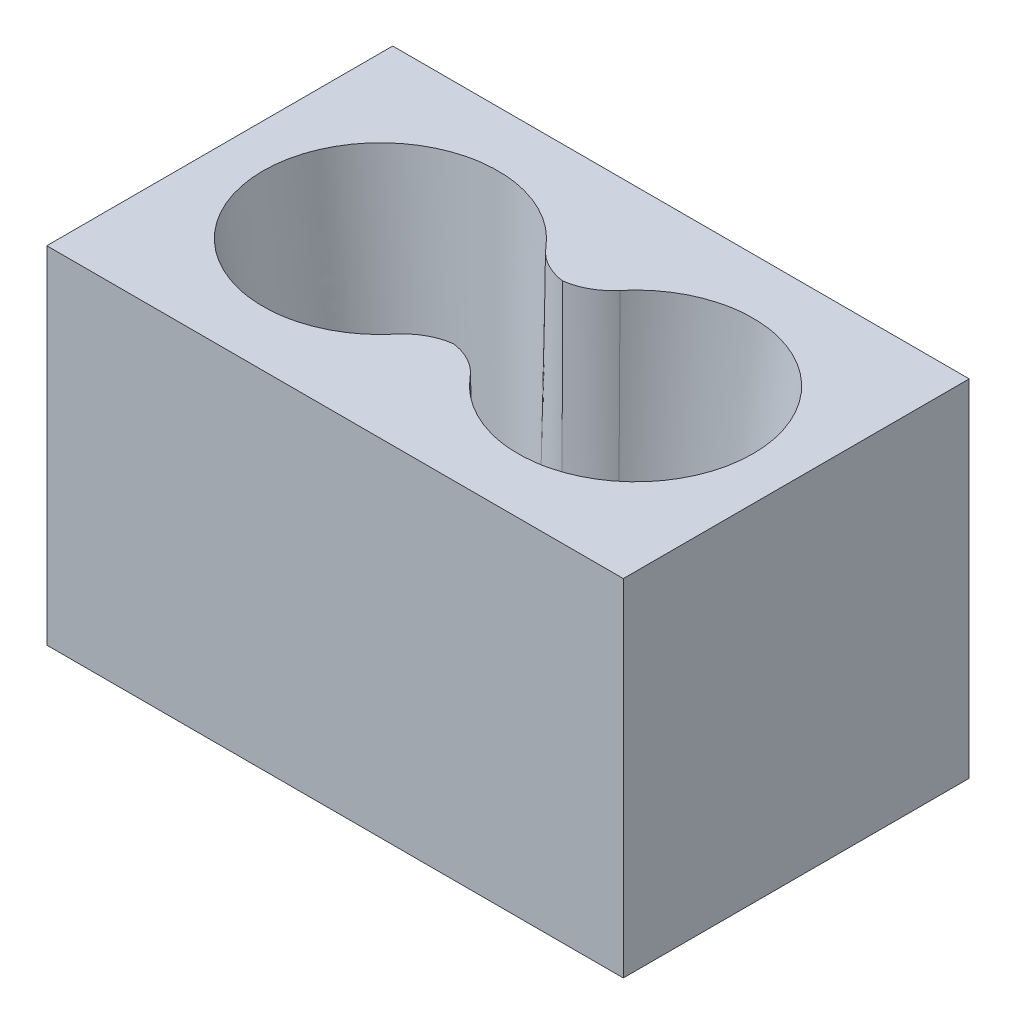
SolidWorks part; units mm, degrees
ref_plane "Front Plane" through (0, 0, 0) normal (0, 0, 1) x (1, 0, 0)
ref_plane "Top Plane" through (0, 0, 0) normal (0, 1, 0) x (1, 0, 0)
ref_plane "Right Plane" through (0, 0, 0) normal (1, 0, 0) x (0, 0, -1)
sketch "Sketch2" plane through (0, 0, 0) normal (0, 1, 0) x (1, 0, 0)
  line L1 (-100, -60) -> (100, -60)
  line L2 (-100, -60) -> (-100, 60)
  line L3 (-100, 60) -> (100, 60)
  line L4 (100, -60) -> (100, 60)
  line L5 (-100, -60) -> (100, 60) construction
  line L6 (-100, 60) -> (100, -60) construction
  point P0 (0, 0)
  dimension "D1" = 200
  dimension "D2" = 120
extrude "Boss-Extrude1" add sketch "Sketch2" along normal blind 120
sketch "Sketch3" plane through (0, 120, 0) normal (0, 1, 0) x (1, 0, 0)
  line L0 (0, 0) -> (0, 60) construction
  line L1 (100, 60) -> (-100, 60) construction
  circle A0 centre (-44.25, 0) radius 40.75
  point P9 (85, 0)
  point P10 (-85, 0)
  dimension "D1" = 81.5
  dimension "D2" = 170
ref_plane "Plane1" through (0, 40, 0) normal (0, 1, 0) x (1, 0, 0)
sketch "Sketch4" plane through (0, 40, 0) normal (0, 1, 0) x (1, 0, 0)
  line L1 (0, 0) -> (0, -60) construction
  line L2 (-100, -60) -> (100, -60) construction
  circle A0 centre (-38.75, 0) radius 35.25
  circle A2 centre (-44.25, 0) radius 40.75 construction
  dimension "D1" = 70.5
loft "Left Cup" cut profiles "Sketch3", "Sketch4"
mirror "Right Cup" about plane through (0, 0, 0) normal (1, 0, 0) of "Left Cup"
sketch "Sketch5" plane through (0, 120, 0) normal (0, 1, 0) x (1, 0, 0)
  line L1 (-28.4817, -18.75) -> (28.4817, -18.75)
  line L2 (-28.4817, -18.75) -> (-28.4817, 18.75)
  line L3 (-28.4817, 18.75) -> (28.4817, 18.75)
  line L4 (28.4817, -18.75) -> (28.4817, 18.75)
  line L5 (-28.4817, -18.75) -> (28.4817, 18.75) construction
  line L6 (-28.4817, 18.75) -> (28.4817, -18.75) construction
  point P0 (0, 0)
  dimension "D1" = 37.5
extrude "Cut-Extrude1" cut sketch "Sketch5" against normal up to surface (80 mm away)
fillet "Fillet1" radius 20 4 edges at (8.5004, 75.1214, 18.75) (-8.2521, 99.9998, 18.75) (8.2522, 99.9998, -18.75) (-8.4983, 75.3587, -18.75)
